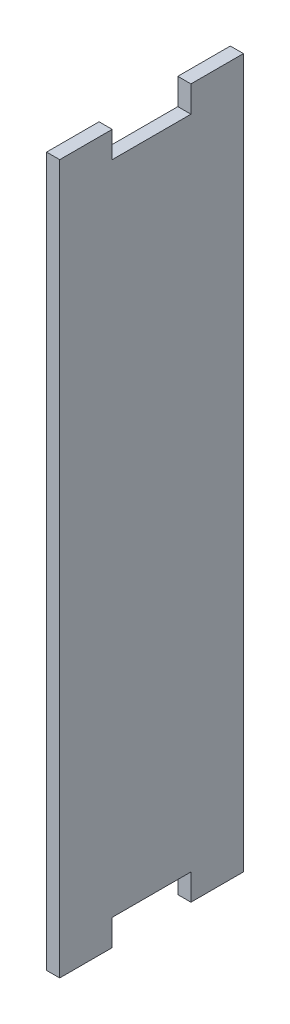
SolidWorks part; units mm, degrees
ref_plane "Front" through (0, 0, 0) normal (0, 0, 1) x (1, 0, 0)
ref_plane "Top" through (0, 0, 0) normal (0, 1, 0) x (1, 0, 0)
ref_plane "Right" through (0, 0, 0) normal (1, 0, 0) x (0, 0, -1)
sketch "Sketch1" plane through (0, 0, 0) normal (1, 0, 0) x (0, 0, -1)
  line L0 (-9.525, 0) -> (9.525, 0)
  line L1 (-9.525, 0) -> (-9.525, -6.35)
  line L2 (-9.525, -6.35) -> (-22.225, -6.35)
  line L3 (-22.225, -6.35) -> (-22.225, 165.1)
  line L8 (-22.225, 165.1) -> (-9.525, 165.1)
  line L9 (0, -1000) -> (0, 49000) construction
  line L10 (9.525, 165.1) -> (9.525, 158.75)
  line L11 (22.225, 165.1) -> (9.525, 165.1)
  line L13 (-9.525, 165.1) -> (-9.525, 158.75)
  line L14 (-9.525, 158.75) -> (9.525, 158.75)
  line L18 (22.225, -6.35) -> (22.225, 165.1)
  line L19 (9.525, -6.35) -> (22.225, -6.35)
  line L20 (9.525, 0) -> (9.525, -6.35)
  dimension "D1" = 6.35
  dimension "D2" = 12.7
  dimension "D3" = 165.1
  dimension "D5" = 19.05
extrude "Extrude1" add sketch "Sketch1" along normal blind 3.175
